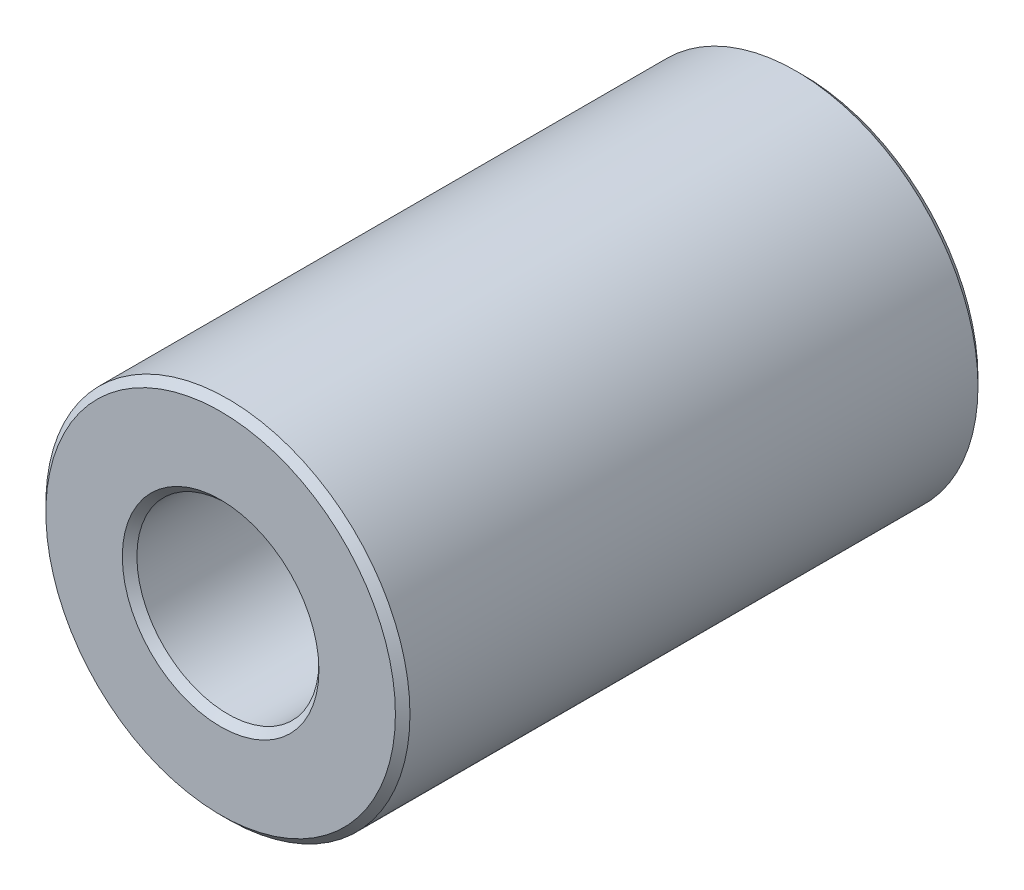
SolidWorks part; units mm, degrees
ref_plane "Front Plane" through (0, 0, 0) normal (0, 0, 1) x (1, 0, 0)
ref_plane "Top Plane" through (0, 0, 0) normal (0, 1, 0) x (1, 0, 0)
ref_plane "Right Plane" through (0, 0, 0) normal (1, 0, 0) x (0, 0, -1)
sketch "Sketch1" plane through (0, 0, 0) normal (0, 0, 1) x (1, 0, 0)
  circle A0 centre (0, 0) radius 2.5
  circle A1 centre (0, 0) radius 1.25
  dimension "D1" = 5
  dimension "D2" = 2.5
extrude "Boss-Extrude2" add sketch "Sketch1" along normal mid plane 8
chamfer "Chamfer3" distance 0.1 angle 45 4 edges at (2.5, 0, 4) (2.5, 0, -4) (1.25, 0, -4) (1.25, 0, 4)
